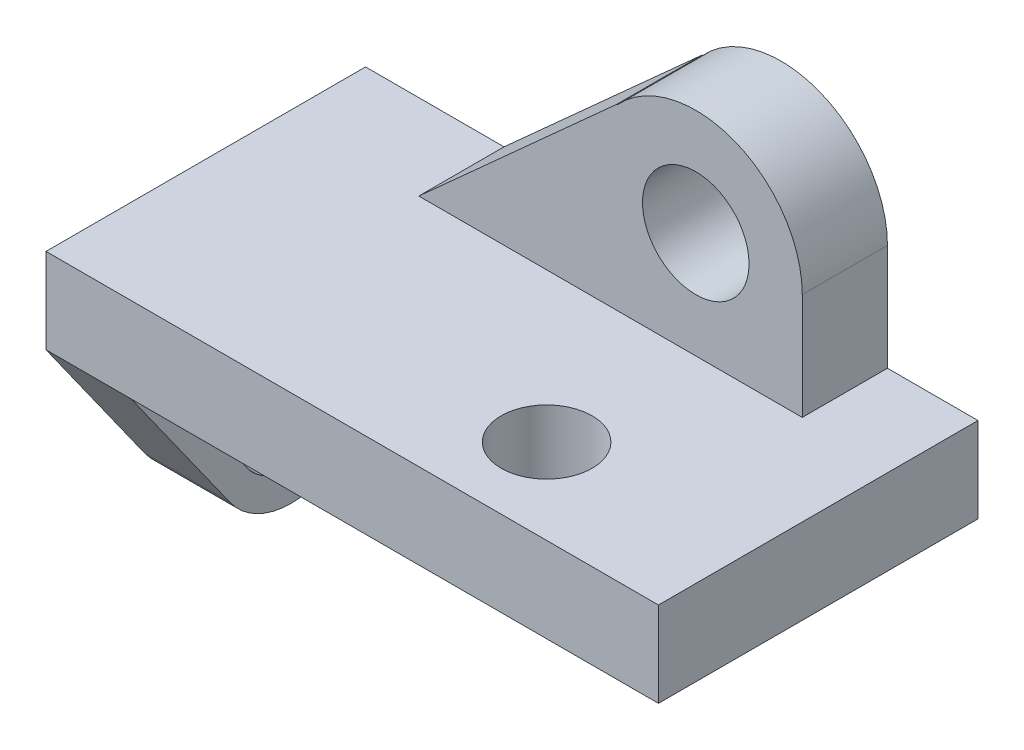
SolidWorks part; units mm, degrees
ref_plane "前视基准面" through (0, 0, 0) normal (0, 0, 1) x (1, 0, 0)
ref_plane "上视基准面" through (0, 0, 0) normal (0, 1, 0) x (1, 0, 0)
ref_plane "右视基准面" through (0, 0, 0) normal (1, 0, 0) x (0, 0, -1)
sketch "草图1" plane through (0, 0, 0) normal (0, 1, 0) x (1, 0, 0)
  line L0 (-32.2774, 0) -> (34.0706, 0) construction
  line L1 (-156, 60) -> (74, 60)
  line L2 (-156, 60) -> (-156, -60)
  line L3 (-156, -60) -> (74, -60)
  line L4 (74, 60) -> (74, -60)
  dimension "D1" = 74
  dimension "D2" = 156
  dimension "D3" = 120
extrude "拉伸1" add sketch "草图1" along normal blind 32
ref_plane "基准面1" through (0, 0, -60) normal (0, 0, 1) x (1, 0, 0)
sketch "草图2" plane through (0, 0, -60) normal (0, 0, 1) x (1, 0, 0)
  line L0 (40, 32) -> (40, 72)
  line L1 (-156, 32) -> (74, 32) construction
  line L2 (-29.6902, 98.9839) -> (-104, 32)
  line L3 (-104, 32) -> (-17.3136, 32)
  line L4 (74, 32) -> (74, 0) construction
  line L5 (0, -21.5581) -> (0, 66.0775) construction
  line L6 (-17.3136, 32) -> (40, 32)
  line L7 (-29.6902, 98.9839) -> (-29.4257, 98.9839)
  arc A0 (40, 71.9341) -> (-29.4257, 98.9839) centre (0.0175, 71.9341) ccw
  circle A1 centre (0.0175, 71.9341) radius 20
  dimension "D1" = 40
  dimension "D2" = 34
  dimension "D4" = 144
extrude "拉伸2" add sketch "草图2" along normal blind 32
sketch "草图3" plane through (-156, 0, 0) normal (-1, 0, 0) x (0, 0, 1)
  line L0 (-60, 0) -> (60, 0)
  line L1 (60, 0) -> (22.9252, -52.1676)
  line L2 (-22.9252, -52.1676) -> (-60, 0)
  line L3 (0, 26.9167) -> (0, -22.2517) construction
  arc A0 (22.9252, -52.1676) -> (-22.9252, -52.1676) centre (0, -35.875) cw
  circle A1 centre (0, -32) radius 20.5526
  point P10 (0, -64)
  dimension "D1" = 64
  dimension "D4" = 32
  dimension "D2" = 64
  dimension "D3" = 64
extrude "拉伸3" add sketch "草图3" against normal blind 32
sketch "草图4" plane through (0, 32, 0) normal (0, 1, 0) x (1, 0, 0)
  line L0 (-156, -60) -> (74, -60) construction
  circle A0 centre (0, -28) radius 17.081
  dimension "D1" = 32
extrude "切除-拉伸1" cut sketch "草图4" against normal through all
